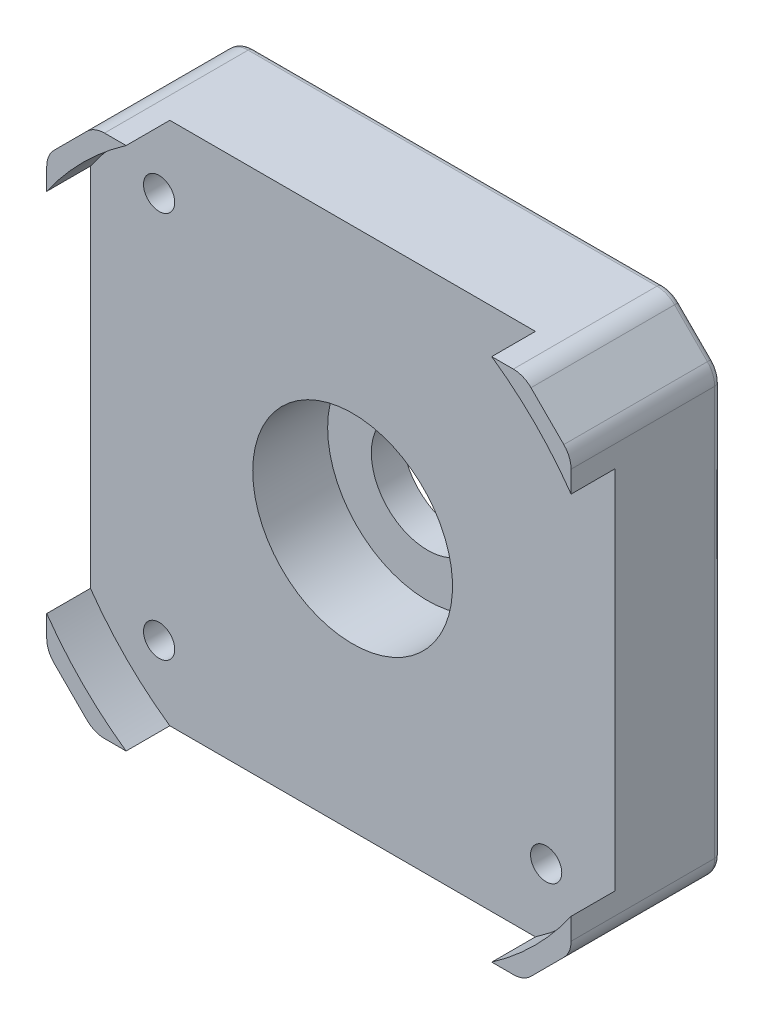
SolidWorks part; units mm, degrees
ref_plane "Front Plane" through (0, 0, 0) normal (0, 0, 1) x (1, 0, 0)
ref_plane "Top Plane" through (0, 0, 0) normal (0, 1, 0) x (1, 0, 0)
ref_plane "Right Plane" through (0, 0, 0) normal (1, 0, 0) x (0, 0, -1)
ref_plane "Plane1" through (0, 0, 7.7) normal (0, 0, 1) x (1, 0, 0)
sketch "Sketch1" plane through (0, 0, 7.7) normal (0, 0, 1) x (1, 0, 0)
  line L0 (-27.5955, 83.6172) -> (6.8045, 83.6172)
  line L1 (6.8045, 83.6172) -> (10.6045, 87.4172)
  line L2 (10.6045, 87.4172) -> (10.6045, 121.8172)
  line L3 (10.6045, 121.8172) -> (6.8045, 125.6172)
  line L4 (6.8045, 125.6172) -> (-27.5955, 125.6172)
  line L5 (-27.5955, 125.6172) -> (-31.3955, 121.8172)
  line L6 (-31.3955, 121.8172) -> (-31.3955, 87.4172)
  line L7 (-31.3955, 87.4172) -> (-27.5955, 83.6172)
extrude "Boss-Extrude1" add sketch "Sketch1" against normal blind 8.5
sketch "Sketch2" plane through (0, 0, 7.7) normal (0, 0, 1) x (1, 0, 0)
  line L0 (-27.5955, 83.6172) -> (-31.3955, 87.4172)
  line L1 (-31.3955, 87.4172) -> (-31.3955, 89.9761)
  line L2 (-25.0365, 83.6172) -> (-27.5955, 83.6172)
  arc A0 (-31.3955, 89.9761) -> (-25.0365, 83.6172) centre (-10.3955, 104.6172) ccw
extrude "Boss-Extrude2" add sketch "Sketch2" along normal blind 3.5
sketch "Sketch3" plane through (0, 0, 7.7) normal (0, 0, 1) x (1, 0, 0)
  line L0 (10.6045, 87.4172) -> (6.8045, 83.6172)
  line L1 (6.8045, 83.6172) -> (4.2455, 83.6172)
  line L2 (10.6045, 89.9761) -> (10.6045, 87.4172)
  arc A0 (4.2455, 83.6172) -> (10.6045, 89.9761) centre (-10.3955, 104.6172) ccw
extrude "Boss-Extrude3" add sketch "Sketch3" along normal blind 3.5
sketch "Sketch4" plane through (0, 0, 7.7) normal (0, 0, 1) x (1, 0, 0)
  line L0 (-31.3955, 121.8172) -> (-27.5955, 125.6172)
  line L1 (-27.5955, 125.6172) -> (-25.0365, 125.6172)
  line L2 (-31.3955, 119.2582) -> (-31.3955, 121.8172)
  arc A0 (-25.0365, 125.6172) -> (-31.3955, 119.2582) centre (-10.3955, 104.6172) ccw
extrude "Boss-Extrude4" add sketch "Sketch4" along normal blind 3.5
sketch "Sketch5" plane through (0, 0, 7.7) normal (0, 0, 1) x (1, 0, 0)
  line L0 (6.8045, 125.6172) -> (10.6045, 121.8172)
  line L1 (10.6045, 121.8172) -> (10.6045, 119.2582)
  line L2 (4.2455, 125.6172) -> (6.8045, 125.6172)
  arc A0 (10.6045, 119.2582) -> (4.2455, 125.6172) centre (-10.3955, 104.6172) ccw
extrude "Boss-Extrude5" add sketch "Sketch5" along normal blind 3.5
ref_plane "Plane2" through (0, 104.6172, 0) normal (0, -1, 0) x (1, 0, 0)
sketch "Sketch6" plane through (0, 104.6172, 0) normal (0, -1, 0) x (1, 0, 0)
  line L0 (-2.3955, 7.7) -> (-10.3955, 7.7)
  line L1 (-10.3955, 7.7) -> (-10.3955, -0.8)
  line L2 (-10.3955, -0.8) -> (-5.8955, -0.8)
  line L3 (-5.8955, -0.8) -> (-5.8955, 1.7)
  line L4 (-5.8955, 1.7) -> (-2.3955, 1.7)
  line L5 (-2.3955, 1.7) -> (-2.3955, 7.7)
  line L6 (-10.3955, 7.7) -> (-10.3955, -0.8) construction
revolve "Cut-Revolve1" cut sketch "Sketch6" angle 360 about L6
hole_wizard "Ø2.5 (2.5) Diameter Hole1" positions "Sketch8" profile "Sketch7" hole size "Ø2.5" standard "ANSI Metric"
sketch "Sketch8" plane through (0, 0, -0.8) normal (0, 0, -1) x (-1, 0, 0)
  point P0 (25.8955, 89.1172)
  point P1 (-5.1045, 89.1172)
  point P2 (-5.1045, 120.1172)
  point P3 (25.8955, 120.1172)
sketch "Sketch7" plane through (-25.8955, 89.1172, -0.8) normal (1, 0, 0) x (0, 1, 0)
  line L0 (0, 0) -> (0, 12)
  line L1 (0, 12) -> (1.25, 12)
  line L2 (1.25, 12) -> (1.25, 0)
  line L5 (1.25, 0) -> (0, 0)
  line L11 (0, -6.35) -> (0, 107.95) construction
  dimension "Thru Hole Dia." = 2.5
  dimension "Thru Hole Depth" = 12
fillet "Fillet1" radius 2 8 edges at (6.8045, 125.6172, 5.2) (-31.3955, 121.8172, 5.2) (-31.3955, 87.4172, 5.2) (10.6045, 87.4172, 5.2) (-27.5955, 125.6172, 5.2) (6.8045, 83.6172, 5.2) (-27.5955, 83.6172, 5.2) (10.6045, 121.8172, 5.2)
chamfer "Chamfer1" distance 2.5 angle 45 4 edges at (3.8545, 89.1172, -0.8) (3.8545, 120.1172, -0.8) (-27.1455, 89.1172, -0.8) (-27.1455, 120.1172, -0.8)
fillet "Fillet2" radius 0.5 16 edges at (-31.2433, 121.7541, -0.8) (-31.3955, 104.6172, -0.8) (-29.4955, 123.7172, -0.8) (-31.2433, 87.4802, -0.8) (-27.5324, 125.4649, -0.8) (-29.4955, 85.5172, -0.8) (-10.3955, 125.6172, -0.8) (-27.5324, 83.7694, -0.8) (6.7414, 125.4649, -0.8) (-10.3955, 83.6172, -0.8) (8.7045, 123.7172, -0.8) (6.7414, 83.7694, -0.8) (10.4523, 121.7541, -0.8) (8.7045, 85.5172, -0.8) (10.6045, 104.6172, -0.8) (10.4523, 87.4802, -0.8)
